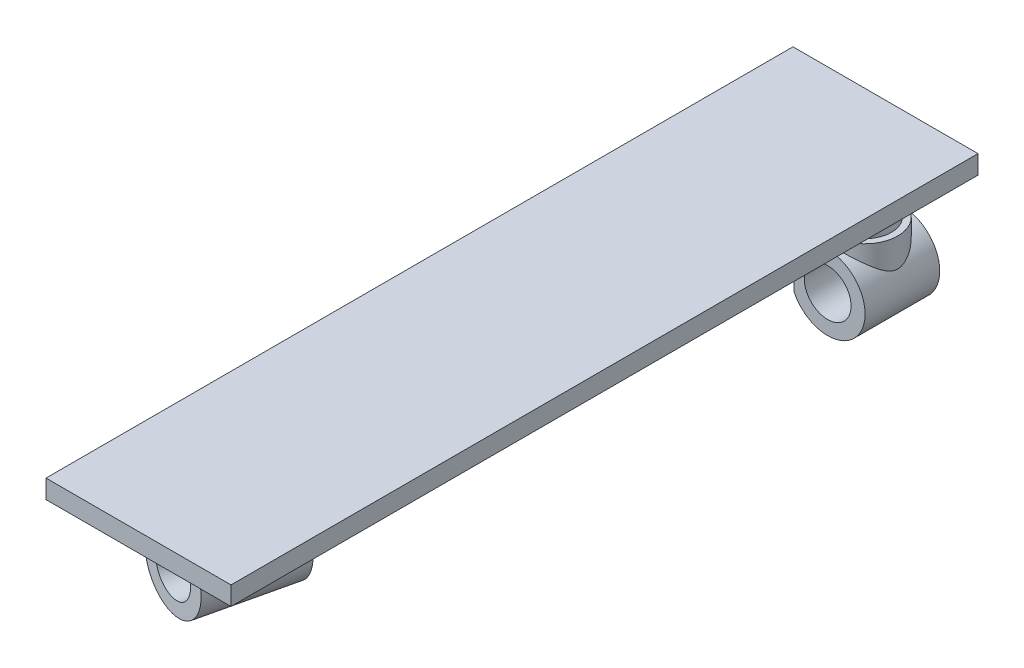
SolidWorks part; units mm, degrees
ref_plane "Plane1" through (0, 0, 0) normal (0, 0, 1) x (1, 0, 0)
ref_plane "Plane2" through (0, 0, 0) normal (0, 1, 0) x (1, 0, 0)
ref_plane "Plane3" through (0, 0, 0) normal (1, 0, 0) x (0, 0, -1)
sketch "Esquisse1" plane through (0, 0, 0) normal (0, 0, 1) x (1, 0, 0)
  circle A0 centre (0, 0) radius 20
  circle A1 centre (0, 0) radius 12.5
  dimension "D1" = 25
  dimension "D2" = 40
extrude "Base-Extrusion" add sketch "Esquisse1" along normal mid plane 40
ref_plane "Plan5" through (0, 55, 0) normal (0, 1, 0) x (-1, 0, 0)
sketch "Esquisse3" plane through (0, 55, 0) normal (0, 1, 0) x (-1, 0, 0)
  circle A0 centre (0, 0) radius 14.1421
extrude "Boss.-Extru.2" add sketch "Esquisse3" along normal up to surface (35 mm away)
ref_plane "Plan7" through (0, 25, 0) normal (0, 1, 0) x (-1, 0, 0)
sketch "Esquisse4" plane through (0, 25, 0) normal (0, 1, 0) x (-1, 0, 0)
  circle A0 centre (0, 0) radius 17.5
  dimension "D1" = 35
extrude "Boss.-Extru.3" add sketch "Esquisse4" along normal up to surface (5 mm away)
chamfer "Chanfrein2" distance 1 angle 45 1 edges at (0, 55, 14.1421)
sketch "Esquisse5" plane through (0, 0, 20) normal (0, 0, 1) x (1, 0, 0)
  line L0 (0, 20.1601) -> (0, -20) construction
  line L1 (-28, 10) -> (-18, 10)
  line L2 (-28, 10) -> (-28, -20)
  line L3 (-28, -20) -> (-18, -20)
  line L4 (-18, 10) -> (-18, -20)
  line L5 (0, 19.9999) -> (0, 25) construction
  dimension "D1" = 18
extrude "Enlèv. mat.-Extru.1" cut sketch "Esquisse5" against normal through all
sketch "Esquisse6" plane through (0, 55, 0) normal (0, 1, 0) x (-1, 0, 0)
  line L1 (-30.7914, -29.6868) -> (68.2785, -29.6868)
  line L2 (-30.7914, -29.6868) -> (-30.7914, 370.3132)
  line L3 (-30.7914, 370.3132) -> (68.2785, 370.3132)
  line L4 (68.2785, -29.6868) -> (68.2785, 370.3132)
  dimension "D1" = 400
extrude "Extrusion1" add sketch "Esquisse6" against normal blind 10
sketch "Esquisse7" plane through (0, 45, 0) normal (0, -1, 0) x (1, 0, 0)
  line L0 (0, 0) -> (0, 370.3132) construction
  line L1 (-68.2785, 370.3132) -> (30.7914, 370.3132) construction
  line L2 (0, 70.0923) -> (-17.807, 171.0807) construction
  circle A2 centre (-40.5389, 300) radius 12.5
  dimension "D2" = 25
  dimension "D1" = 10
  dimension "D3" = 300
extrude "Extrusion3" add sketch "Esquisse7" along normal blind 20
sketch "Esquisse10" plane through (0, 25, 0) normal (0, -1, 0) x (1, 0, 0)
  circle A0 centre (-40.5389, 300) radius 17.5
extrude "Extrusion4" add sketch "Esquisse10" along normal blind 25
sketch "Esquisse12" plane through (0, 0, 0) normal (0, 1, 0) x (1, 0, 0)
  line L0 (-33.9831, -327.1711) -> (-26.6753, -328.8583)
  line L1 (-26.6753, -328.8583) -> (-15.4278, -280.1398)
  line L2 (-15.4278, -280.1398) -> (-22.7355, -278.4526)
  line L3 (-22.7355, -278.4526) -> (-26.8381, -296.223)
  line L5 (-40.5389, -300) -> (-26.8431, -240.6769) construction
  line L6 (-29.8805, -309.4008) -> (-33.9831, -327.1711)
  arc A0 (-29.8805, -309.4008) -> (-26.8381, -296.223) centre (-40.5389, -300) ccw
revolve "Révolution1" add sketch "Esquisse12" angle 360 about L5
sketch "Esquisse13" plane through (-73.4308, 0, 318.0639) normal (-0.225, 0, 0.9744) x (0.9744, 0, 0.225)
  line L0 (15.4854, 0) -> (40.4854, 0) construction
  circle A0 centre (27.9854, 0) radius 12.5
extrude "Enlèv. mat.-Extru.2" cut sketch "Esquisse13" against normal blind 60
